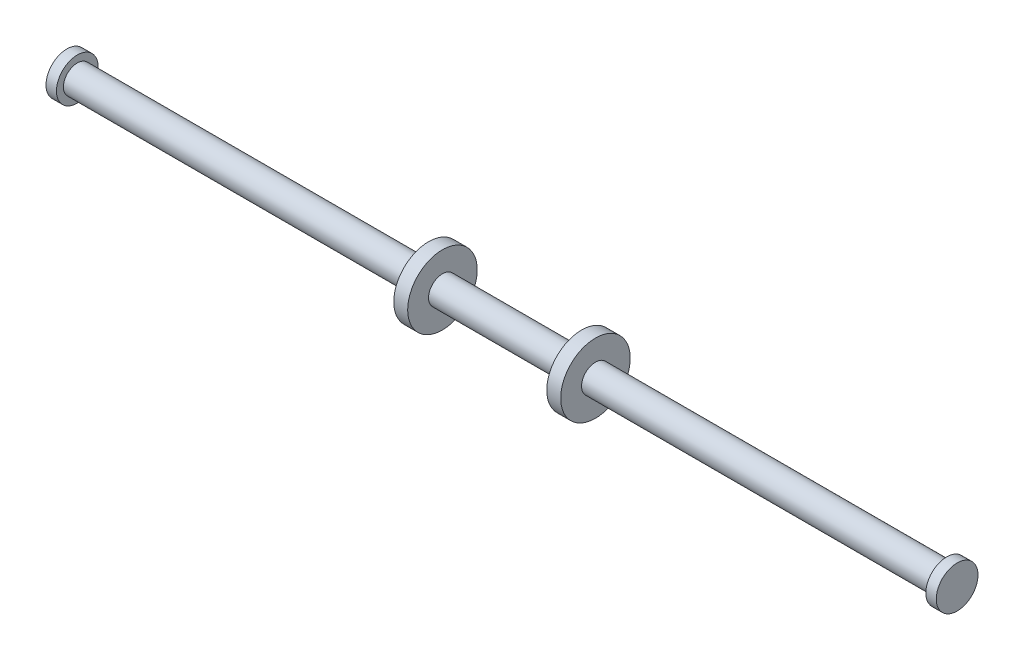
SolidWorks part; units mm, degrees
ref_plane "Front Plane" through (0, 0, 0) normal (0, 0, 1) x (1, 0, 0)
ref_plane "Top Plane" through (0, 0, 0) normal (0, 1, 0) x (1, 0, 0)
ref_plane "Right Plane" through (0, 0, 0) normal (1, 0, 0) x (0, 0, -1)
sketch "Sketch1" plane through (0, 0, 0) normal (1, 0, 0) x (0, 0, -1)
  circle A0 centre (0, 0) radius 2
  dimension "D1" = 4
extrude "Boss-Extrude1" add sketch "Sketch1" along normal blind 128
sketch "Sketch2" plane through (128, 0, 0) normal (1, 0, 0) x (0, 0, -1)
  circle A0 centre (0, 0) radius 3
  dimension "D1" = 6
extrude "Boss-Extrude2" add sketch "Sketch2" against normal blind 1.5
sketch "Sketch3" plane through (0, 0, 0) normal (-1, 0, 0) x (0, 0, 1)
  circle A1 centre (0, 0) radius 3
  circle A2 centre (0, 0) radius 3
  dimension "D1" = 0
extrude "Boss-Extrude3" add sketch "Sketch3" against normal blind 1.5
sketch "Sketch4" plane through (0, 0, 0) normal (-1, 0, 0) x (0, 0, 1)
  circle A0 centre (0, 0) radius 5
  dimension "D1" = 10
extrude "Boss-Extrude4" add sketch "Sketch4" along normal blind 2 from offset 54
sketch "Sketch5" plane through (128, 0, 0) normal (1, 0, 0) x (0, 0, -1)
  circle A1 centre (0, 0) radius 5
  circle A2 centre (0, 0) radius 5
  dimension "D1" = 0
extrude "Boss-Extrude5" add sketch "Sketch5" along normal blind 2 from offset 54
